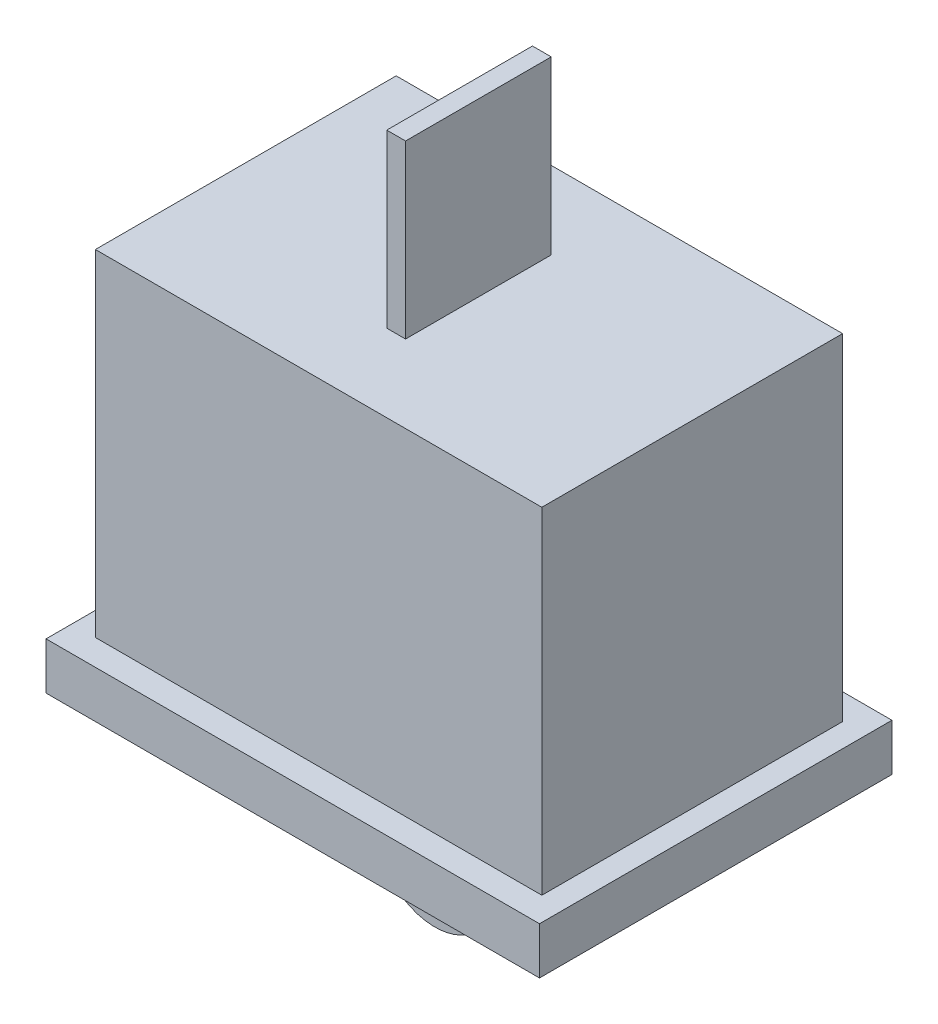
SolidWorks part; units mm, degrees
ref_plane "前视基准面" through (0, 0, 0) normal (0, 0, 1) x (1, 0, 0)
ref_plane "上视基准面" through (0, 0, 0) normal (0, 1, 0) x (1, 0, 0)
ref_plane "右视基准面" through (0, 0, 0) normal (1, 0, 0) x (0, 0, -1)
other "Configuration Table"
sketch "草图1" plane through (0, 0, 0) normal (0, 1, 0) x (1, 0, 0)
  line L1 (-10.5, 7.5) -> (10.5, 7.5)
  line L2 (-10.5, 7.5) -> (-10.5, -7.5)
  line L3 (-10.5, -7.5) -> (10.5, -7.5)
  line L4 (10.5, 7.5) -> (10.5, -7.5)
  line L5 (-10.5, 7.5) -> (10.5, -7.5) construction
  line L6 (-10.5, -7.5) -> (10.5, 7.5) construction
  point P0 (0, 0)
  dimension "D1" = 15
  dimension "D2" = 21
extrude "凸台-拉伸1" add sketch "草图1" along normal blind 2
sketch "草图2" plane through (0, 2, 0) normal (0, 1, 0) x (1, 0, 0)
  line L1 (-9.5, 6.4) -> (9.5, 6.4)
  line L2 (-9.5, 6.4) -> (-9.5, -6.4)
  line L3 (-9.5, -6.4) -> (9.5, -6.4)
  line L4 (9.5, 6.4) -> (9.5, -6.4)
  line L5 (-9.5, 6.4) -> (9.5, -6.4) construction
  line L6 (-9.5, -6.4) -> (9.5, 6.4) construction
  point P0 (0, 0)
  dimension "D1" = 19
  dimension "D2" = 12.8
extrude "凸台-拉伸2" add sketch "草图2" along normal blind 14.3
sketch "草图3" plane through (0, 16.3, 0) normal (0, 1, 0) x (1, 0, 0)
  line L1 (-0.4, 3.1) -> (0.4, 3.1)
  line L2 (-0.4, 3.1) -> (-0.4, -3.1)
  line L3 (-0.4, -3.1) -> (0.4, -3.1)
  line L4 (0.4, 3.1) -> (0.4, -3.1)
  line L5 (-0.4, 3.1) -> (0.4, -3.1) construction
  line L6 (-0.4, -3.1) -> (0.4, 3.1) construction
  point P0 (0, 0)
  dimension "D1" = 0.8
  dimension "D2" = 6.2
extrude "凸台-拉伸3" add sketch "草图3" along normal blind 7.3
sketch "草图4" plane through (0, 0, 0) normal (0, 0, 1) x (1, 0, 0)
  line L0 (-4.6659, 0) -> (6.0537, 0)
  line L1 (-10.5, 0) -> (10.5, 0) construction
  arc A0 (1.9825, -2.3061) -> (6.0537, 0) centre (3.5473, -0.3219) ccw
  arc A1 (1.9825, -2.3061) -> (-4.6659, 0) centre (-4.6659, -10.7366) ccw
extrude "凸台-拉伸4" add sketch "草图4" along normal mid plane 10
